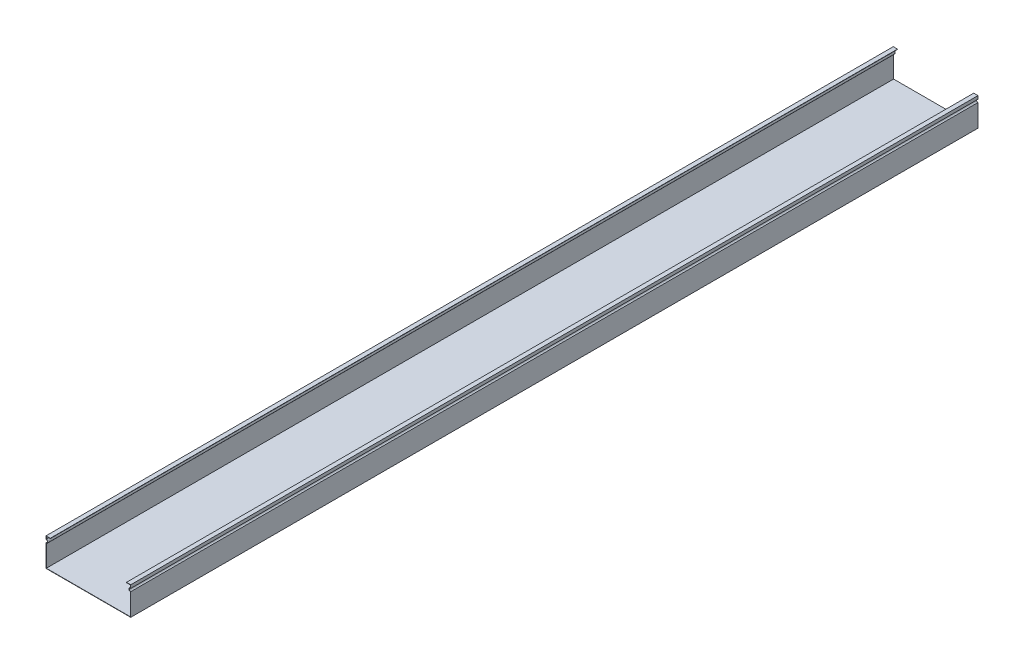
SolidWorks part; units mm, degrees
ref_plane "Front Plane" through (0, 0, 0) normal (0, 0, 1) x (1, 0, 0)
ref_plane "Top Plane" through (0, 0, 0) normal (0, 1, 0) x (1, 0, 0)
ref_plane "Right Plane" through (0, 0, 0) normal (1, 0, 0) x (0, 0, -1)
sketch "Sketch2" plane through (0, 0, 0) normal (0, 0, 1) x (1, 0, 0)
  line L0 (-15, 0) -> (-15, -11.2141)
  line L1 (0, 0) -> (-15, 0)
  line L2 (-15, -21.2141) -> (-15, -100)
  line L3 (0, -1.2141) -> (-13.7859, -1.2141)
  line L4 (-15, -100) -> (285, -100)
  line L5 (285, -100) -> (285, -21.2141)
  line L6 (285, -11.2141) -> (285, 0)
  line L7 (285, 0) -> (270, 0)
  line L8 (-13.7859, -1.2141) -> (-13.7859, -10.1198)
  line L9 (-13.7859, -22.3085) -> (-13.7859, -98.7859)
  line L10 (-13.7859, -98.7859) -> (283.7859, -98.7859)
  line L11 (283.7859, -98.7859) -> (283.7859, -22.3085)
  line L12 (283.7859, -10.1198) -> (283.7859, -1.2141)
  line L13 (283.7859, -1.2141) -> (270, -1.2141)
  line L14 (0, 0) -> (0, -1.2141)
  line L15 (270, 0) -> (270, -1.2141)
  arc A0 (-15, -11.2141) -> (-15, -21.2141) centre (-15, -16.2141) cw
  arc A1 (285, -11.2141) -> (285, -21.2141) centre (285, -16.2141) ccw
  arc A2 (-13.7859, -10.1198) -> (-13.7859, -22.3085) centre (-15, -16.2141) cw
  arc A3 (283.7859, -10.1198) -> (283.7859, -22.3085) centre (285, -16.2141) ccw
  point P27 (0.6132, -0.3906)
  point P28 (16.5239, -4.9568)
  dimension "D3" = 5
  dimension "D1" = 100
  dimension "D2" = 300
  dimension "D4" = 1.2141
  dimension "D5" = 15
  dimension "D6" = 15
extrude "Extrude1" add sketch "Sketch2" along normal blind 3000
